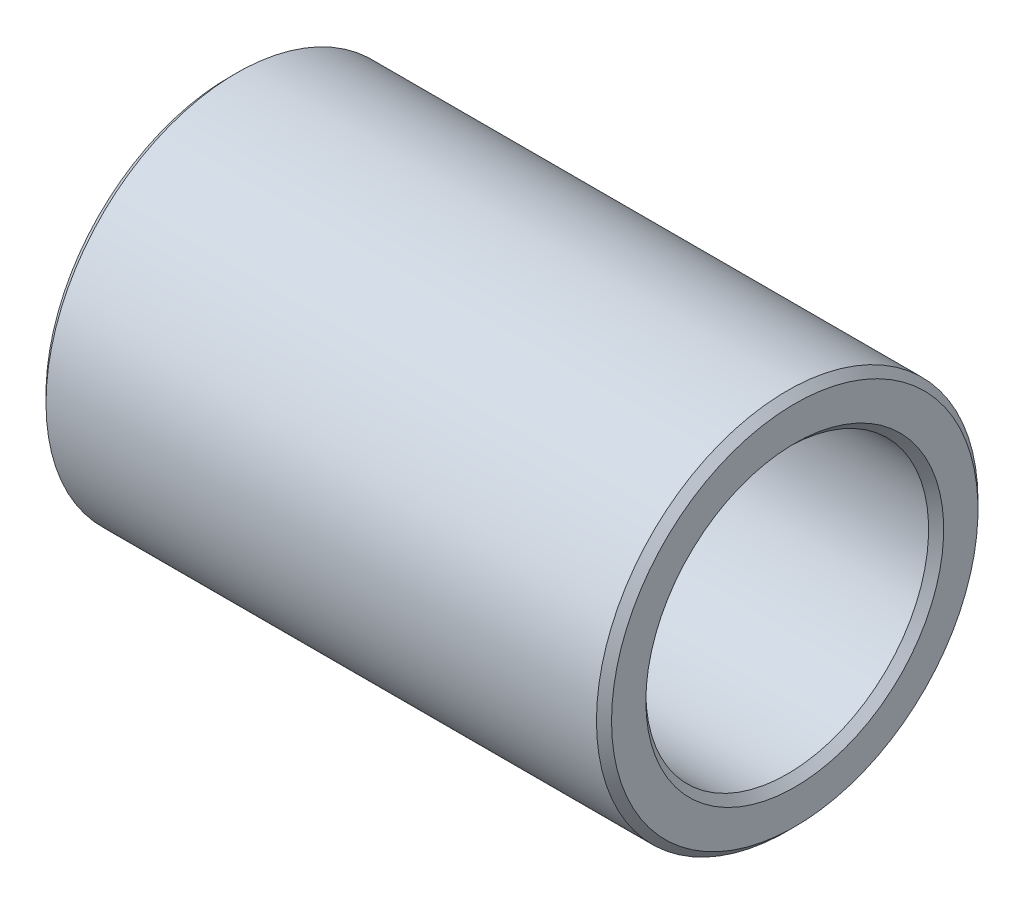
SolidWorks part; units mm, degrees
ref_plane "Front Plane" through (0, 0, 0) normal (0, 0, 1) x (1, 0, 0)
ref_plane "Top Plane" through (0, 0, 0) normal (0, 1, 0) x (1, 0, 0)
ref_plane "Right Plane" through (0, 0, 0) normal (1, 0, 0) x (0, 0, -1)
sketch "Sketch1" plane through (0, 0, 0) normal (0, 0, 1) x (1, 0, 0)
  line L0 (0, 0) -> (47.0192, 0) construction
  line L1 (0, 0) -> (0, 2.3813) construction
  line L2 (-4.7625, 3.2131) -> (4.7625, 3.2131)
  line L3 (-4.7625, 3.2131) -> (-4.7625, 2.3813)
  line L4 (-4.7625, 2.3813) -> (4.7625, 2.3813)
  line L5 (4.7625, 3.2131) -> (4.7625, 2.3813)
  dimension "D1" = 4.7625
  dimension "D2" = 6.4262
  dimension "D3" = 9.525
revolve "Revolve1" add sketch "Sketch1" angle 360 about L0
chamfer "Chamfer1" distance 0.127 angle 45 4 edges at (-4.7625, 0, 3.2131) (-4.7625, 0, 2.3813) (4.7625, 0, 2.3813) (4.7625, 0, 3.2131)
